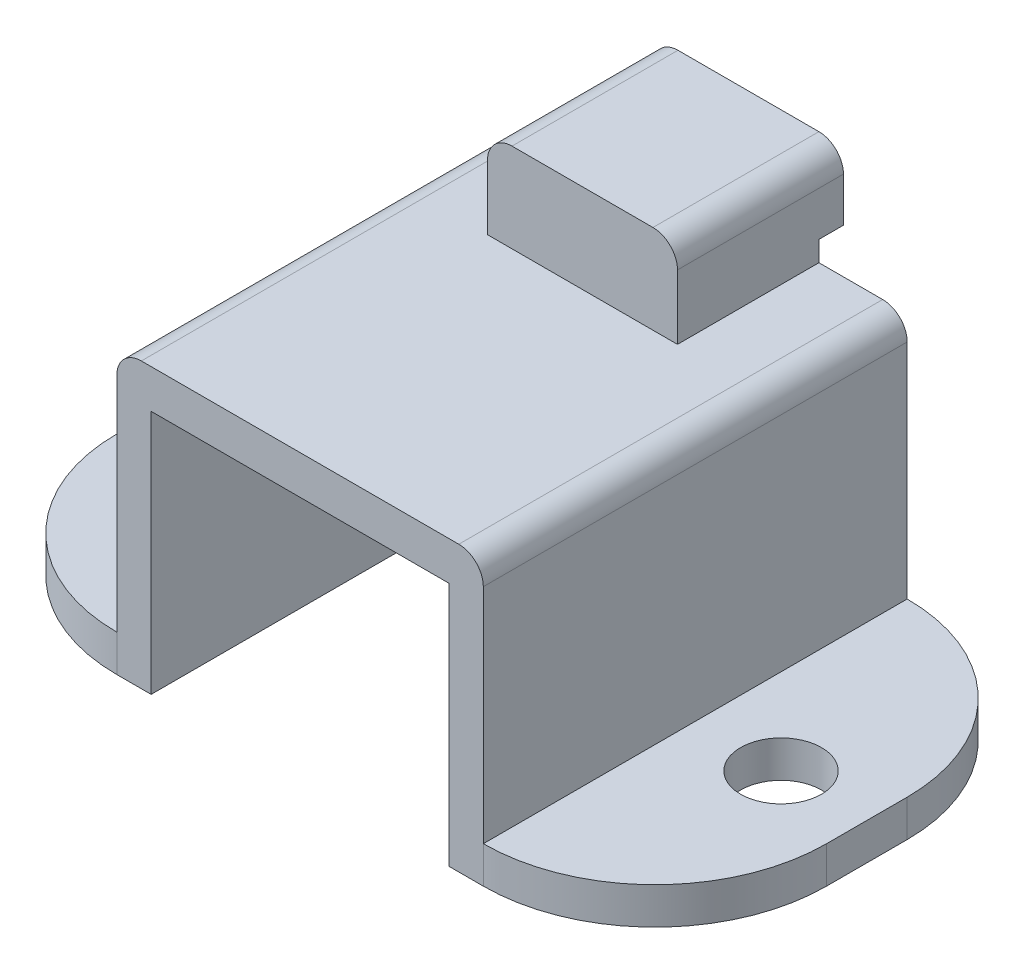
SolidWorks part; units mm, degrees
ref_plane "Front Plane" through (0, 0, 0) normal (0, 0, 1) x (1, 0, 0)
ref_plane "Top Plane" through (0, 0, 0) normal (0, 1, 0) x (1, 0, 0)
ref_plane "Right Plane" through (0, 0, 0) normal (1, 0, 0) x (0, 0, -1)
sketch "Sketch1" plane through (0, 0, 0) normal (0, 0, 1) x (1, 0, 0)
  line L0 (-7.475, 0) -> (58.928, 0) construction
  line L1 (-7.475, 11.58) -> (7.475, 11.58)
  line L2 (7.475, 11.58) -> (7.475, 0)
  line L3 (0, -8.3655) -> (0, 8.3655) construction
  line L4 (-7.475, 11.58) -> (-7.475, 0)
  line L5 (0, 0) -> (0, 18.7707) construction
  line L6 (6.075, 0) -> (6.075, 10)
  line L7 (6.075, 10) -> (-6.075, 10)
  line L8 (-6.075, 0) -> (-6.075, 10)
  line L9 (-7.475, 0) -> (-6.075, 0)
  line L10 (6.075, 0) -> (7.475, 0)
  point P9 (0, 11.58)
  point P16 (0, 10)
  dimension "D1" = 14.95
  dimension "D2" = 11.58
  dimension "D3" = 10
  dimension "D4" = 12.15
extrude "Boss-Extrude1" add sketch "Sketch1" along normal blind 9.17
sketch "Sketch5" plane through (0, 0, 0) normal (0, 0, -1) x (-1, 0, 0)
  line L8 (6.075, 0) -> (7.475, 0)
  line L9 (7.475, 0) -> (7.475, 11.58)
  line L10 (7.475, 11.58) -> (-7.475, 11.58)
  line L11 (-7.475, 11.58) -> (-7.475, 0)
  line L12 (-7.475, 0) -> (-6.075, 0)
  line L13 (-6.075, 0) -> (-6.075, 10)
  line L14 (-6.075, 10) -> (6.075, 10)
  line L15 (6.075, 10) -> (6.075, 0)
  line L16 (6.075, 0) -> (7.475, 0)
  line L17 (7.475, 0) -> (7.475, 11.58)
  line L18 (7.475, 11.58) -> (-7.475, 11.58)
  line L19 (-7.475, 11.58) -> (-7.475, 0)
  line L20 (-7.475, 0) -> (-6.075, 0)
  line L21 (-6.075, 0) -> (-6.075, 7)
  line L22 (-3.075, 10) -> (3.075, 10)
  line L23 (6.075, 7) -> (6.075, 0)
  arc A0 (3.075, 10) -> (6.075, 7) centre (3.075, 7) cw
  arc A1 (-6.075, 7) -> (-3.075, 10) centre (-3.075, 7) cw
  dimension "D2" = 3
  dimension "D1" = 0
extrude "Boss-Extrude5" add sketch "Sketch5" along normal blind 2.35
sketch "Sketch7" plane through (0, 0, -2.35) normal (0, 0, -1) x (-1, 0, 0)
  line L8 (6.075, 7) -> (6.075, 0)
  line L9 (6.075, 0) -> (7.475, 0)
  line L10 (7.475, 0) -> (7.475, 11.58)
  line L11 (7.475, 11.58) -> (-7.475, 11.58)
  line L12 (-7.475, 11.58) -> (-7.475, 0)
  line L13 (-7.475, 0) -> (-6.075, 0)
  line L14 (-6.075, 0) -> (-6.075, 7)
  line L15 (-3.075, 10) -> (3.075, 10)
  line L16 (6.075, 7) -> (6.075, 0)
  line L17 (6.075, 0) -> (7.475, 0)
  line L18 (7.475, 0) -> (7.475, 11.58)
  line L19 (7.475, 11.58) -> (-7.475, 11.58)
  line L20 (-7.475, 11.58) -> (-7.475, 0)
  line L21 (-7.475, 0) -> (-6.075, 0)
  line L22 (-6.075, 0) -> (-6.075, 7)
  line L23 (-3.075, 10) -> (3.075, 10)
  arc A2 (-3.075, 10) -> (-6.075, 7) centre (-3.075, 7) ccw
  arc A3 (6.075, 7) -> (3.075, 10) centre (3.075, 7) ccw
  arc A4 (-3.075, 10) -> (-6.075, 7) centre (-3.075, 7) ccw
  arc A5 (6.075, 7) -> (3.075, 10) centre (3.075, 7) ccw
  dimension "D1" = 0
sketch "Sketch9" plane through (0, 0, -2.35) normal (0, 0, -1) x (-1, 0, 0)
  line L8 (6.075, 7) -> (6.075, 0)
  line L9 (6.075, 0) -> (7.475, 0)
  line L10 (7.475, 0) -> (7.475, 11.58)
  line L11 (7.475, 11.58) -> (-7.475, 11.58)
  line L12 (-7.475, 11.58) -> (-7.475, 0)
  line L13 (-7.475, 0) -> (-6.075, 0)
  line L14 (-6.075, 0) -> (-6.075, 7)
  line L15 (-3.075, 10) -> (3.075, 10)
  line L16 (6.075, 7) -> (6.075, 0)
  line L17 (6.075, 0) -> (7.475, 0)
  line L18 (7.475, 0) -> (7.475, 11.58)
  line L19 (7.475, 11.58) -> (-7.475, 11.58)
  line L20 (-7.475, 11.58) -> (-7.475, 0)
  line L21 (-7.475, 0) -> (-6.075, 0)
  line L22 (-6.075, 0) -> (-6.075, 7)
  line L23 (-3.075, 10) -> (3.075, 10)
  arc A2 (-3.075, 10) -> (-6.075, 7) centre (-3.075, 7) ccw
  arc A3 (6.075, 7) -> (3.075, 10) centre (3.075, 7) ccw
  arc A4 (-3.075, 10) -> (-6.075, 7) centre (-3.075, 7) ccw
  arc A5 (6.075, 7) -> (3.075, 10) centre (3.075, 7) ccw
  dimension "D1" = 0
extrude "Boss-Extrude6" add sketch "Sketch9" along normal blind 1.07 separate body
sketch "Sketch10" plane through (0, 0, -3.42) normal (0, 0, -1) x (-1, 0, 0)
  line L0 (0, 0) -> (0, 10) construction
  line L1 (-2.375, 13.61) -> (2.375, 13.61)
  line L2 (2.375, 13.61) -> (2.375, 10)
  line L3 (-2.375, 13.61) -> (-2.375, 10)
  line L4 (2.375, 10) -> (3.075, 10)
  line L5 (0, 11.58) -> (0, 17.0094) construction
  line L6 (3.875, 11.58) -> (3.875, 15.21)
  line L7 (3.875, 15.21) -> (-3.875, 15.21)
  line L8 (6.075, 7) -> (6.075, 0)
  line L9 (6.075, 0) -> (7.475, 0)
  line L10 (7.475, 0) -> (7.475, 11.58)
  line L11 (7.475, 11.58) -> (-7.475, 11.58)
  line L12 (-7.475, 11.58) -> (-7.475, 0)
  line L13 (-7.475, 0) -> (-6.075, 0)
  line L14 (-6.075, 0) -> (-6.075, 7)
  line L15 (-3.075, 10) -> (3.075, 10)
  line L16 (6.075, 7) -> (6.075, 0)
  line L17 (6.075, 0) -> (7.475, 0)
  line L18 (7.475, 0) -> (7.475, 11.58)
  line L19 (7.475, 11.58) -> (-7.475, 11.58)
  line L20 (-7.475, 11.58) -> (-7.475, 0)
  line L21 (-7.475, 0) -> (-6.075, 0)
  line L22 (-6.075, 0) -> (-6.075, 7)
  line L23 (-3.075, 10) -> (-2.375, 10)
  line L24 (-3.875, 11.58) -> (-7.475, 11.58)
  line L25 (3.875, 11.58) -> (7.475, 11.58)
  line L26 (-3.875, 11.58) -> (-3.875, 15.21)
  arc A2 (6.075, 7) -> (3.075, 10) centre (3.075, 7) ccw
  arc A3 (-3.075, 10) -> (-6.075, 7) centre (-3.075, 7) ccw
  arc A4 (6.075, 7) -> (3.075, 10) centre (3.075, 7) ccw
  arc A5 (-3.075, 10) -> (-6.075, 7) centre (-3.075, 7) ccw
  point P15 (0, 13.61)
  point P27 (0, 15.21)
  dimension "D2" = 4.75
  dimension "D3" = 3.61
  dimension "D4" = 1.5
  dimension "D5" = 1.6
  dimension "D1" = 0
extrude "Boss-Extrude7" add sketch "Sketch10" along normal blind 4.7 contours L3 L19 M21 M22 M23 M24 M25 M26 | L26 L3 L1 L2 L6 L7 M21 | L2 M21 M26 M17 M18 M19 M20
sketch "Sketch11" plane through (0, 0, -3.42) normal (0, 0, 1) x (1, 0, 0)
  line L0 (-3.875, 15.21) -> (3.875, 15.21)
  line L1 (3.875, 15.21) -> (3.875, 10)
  line L2 (-6.075, 10) -> (6.075, 10) construction
  line L3 (3.875, 10) -> (-3.875, 10)
  line L4 (-6.075, 10) -> (-3.075, 10) construction
  line L5 (-3.875, 10) -> (-3.875, 15.21)
extrude "Boss-Extrude8" add sketch "Sketch11" along normal up to vertex (1.07 mm away)
fillet "Fillet4" radius 1 6 edges at (7.475, 11.58, 0.525) (-7.475, 11.58, 0.525) (-3.875, 15.21, -5.235) (3.875, 15.21, -5.235) (-2.375, 13.61, -5.77) (2.375, 13.61, -5.77)
sketch "Sketch12" plane through (0, 0, 0) normal (0, -1, 0) x (1, 0, 0)
  line L0 (14.475, 0.525) -> (-5.1957, 0.525) construction
  line L1 (6.075, 9.17) -> (14.475, 9.17)
  line L2 (6.075, 9.17) -> (6.075, -8.12)
  line L3 (6.075, -8.12) -> (14.475, -8.12)
  line L4 (14.475, 9.17) -> (14.475, -8.12)
  line L5 (7.475, 0.525) -> (14.475, 0.525) construction
  line L6 (7.475, 9.17) -> (7.475, -8.12) construction
  circle A0 centre (10.975, 0.525) radius 1.65
  dimension "D1" = 7
  dimension "D2" = 3.3
extrude "Boss-Extrude9" add sketch "Sketch12" against normal blind 1.5
mirror "Mirror1" about plane through (0, 0, 0) normal (1, 0, 0) of "Boss-Extrude9"
fillet "Fillet6" radius 7 4 edges at (-14.475, 0.75, 9.17) (-14.475, 0.75, -8.12) (14.475, 0.75, -8.12) (14.475, 0.75, 9.17)
sketch "Sketch13" plane through (0, 0, 0) normal (0, -1, 0) x (1, 0, 0)
  line L0 (1.6334, 9.17) -> (10.975, 0.525)
  line L1 (-6.075, 9.17) -> (6.075, 9.17) construction
sketch "Sketch14" plane through (0, 0, -8.12) normal (0, 0, -1) x (-1, 0, 0)
  line L0 (-3.875, 12.4039) -> (3.875, 12.4039)
  line L18 (6.075, 0) -> (7.475, 0)
  line L19 (7.475, 0) -> (7.475, 1.5)
  line L20 (7.475, 1.5) -> (7.475, 10.58)
  line L21 (6.475, 11.58) -> (3.875, 11.58)
  line L22 (3.875, 11.58) -> (3.875, 14.21)
  line L23 (2.875, 15.21) -> (-2.875, 15.21)
  line L24 (-3.875, 14.21) -> (-3.875, 11.58)
  line L25 (-3.875, 11.58) -> (-6.475, 11.58)
  line L26 (-7.475, 10.58) -> (-7.475, 1.5)
  line L27 (-7.475, 1.5) -> (-7.475, 0)
  line L28 (-7.475, 0) -> (-6.075, 0)
  line L29 (-6.075, 0) -> (-6.075, 7)
  line L30 (-3.075, 10) -> (-2.375, 10)
  line L31 (-2.375, 10) -> (-2.375, 12.61)
  line L32 (-1.375, 13.61) -> (1.375, 13.61)
  line L33 (2.375, 12.61) -> (2.375, 10)
  line L34 (2.375, 10) -> (3.075, 10)
  line L35 (6.075, 7) -> (6.075, 0)
  line L36 (6.075, 0) -> (7.475, 0)
  line L40 (3.875, 12.4039) -> (3.875, 14.21)
  line L41 (2.875, 15.21) -> (-2.875, 15.21)
  line L42 (-3.875, 14.21) -> (-3.875, 12.4039)
  line L49 (-2.375, 12.4039) -> (-2.375, 12.61)
  line L50 (-1.375, 13.61) -> (1.375, 13.61)
  line L51 (2.375, 12.61) -> (2.375, 12.4039)
  arc A8 (7.475, 10.58) -> (6.475, 11.58) centre (6.475, 10.58) ccw
  arc A9 (3.875, 14.21) -> (2.875, 15.21) centre (2.875, 14.21) ccw
  arc A10 (-2.875, 15.21) -> (-3.875, 14.21) centre (-2.875, 14.21) ccw
  arc A11 (-6.475, 11.58) -> (-7.475, 10.58) centre (-6.475, 10.58) ccw
  arc A12 (-3.075, 10) -> (-6.075, 7) centre (-3.075, 7) ccw
  arc A13 (-1.375, 13.61) -> (-2.375, 12.61) centre (-1.375, 12.61) ccw
  arc A14 (2.375, 12.61) -> (1.375, 13.61) centre (1.375, 12.61) ccw
  arc A15 (6.075, 7) -> (3.075, 10) centre (3.075, 7) ccw
  arc A17 (3.875, 14.21) -> (2.875, 15.21) centre (2.875, 14.21) ccw
  arc A18 (-2.875, 15.21) -> (-3.875, 14.21) centre (-2.875, 14.21) ccw
  arc A21 (-1.375, 13.61) -> (-2.375, 12.61) centre (-1.375, 12.61) ccw
  arc A22 (2.375, 12.61) -> (1.375, 13.61) centre (1.375, 12.61) ccw
  dimension "D1" = 0
extrude "Boss-Extrude10" add sketch "Sketch14" along normal blind 1 contours L0 M36 M45 M46 M47 M48 M49 M32 M33 M34 M35 | L0 M45 M49 M48 M47 M46
